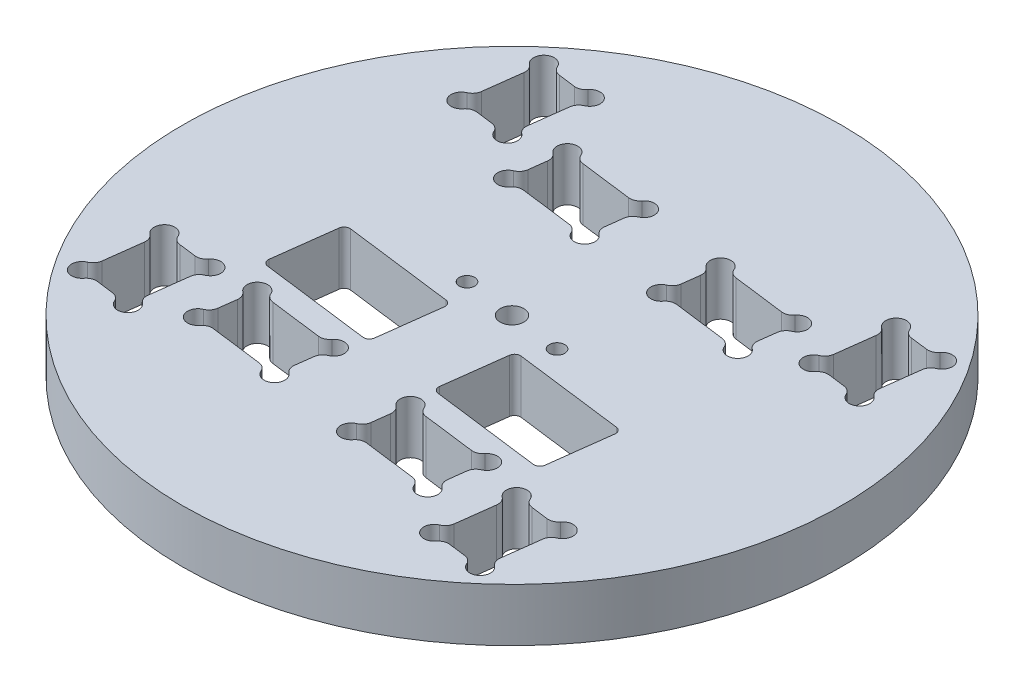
SolidWorks part; units mm, degrees
ref_plane "Front Plane" through (0, 0, 0) normal (0, 0, 1) x (1, 0, 0)
ref_plane "Top Plane" through (0, 0, 0) normal (0, 1, 0) x (1, 0, 0)
ref_plane "Right Plane" through (0, 0, 0) normal (1, 0, 0) x (0, 0, -1)
sketch "Sketch1" plane through (0, 0, 0) normal (0, 1, 0) x (1, 0, 0)
  line L1 (-78, -80) -> (78, -80) construction
  line L2 (-78, -80) -> (-78, 80) construction
  line L3 (-78, 80) -> (78, 80) construction
  line L4 (78, -80) -> (78, 80) construction
  line L5 (-78, -80) -> (78, 80) construction
  line L6 (-78, 80) -> (78, -80) construction
  arc A0 (-78, -80) -> (78, -80) centre (0, 0) ccw construction
  arc A1 (-78, -80) -> (78, -80) centre (0, 0) ccw construction
  arc A2 (78, 80) -> (-78, 80) centre (0, 0) ccw construction
  arc A3 (78, 80) -> (-78, 80) centre (0, 0) ccw construction
  circle A4 centre (0, 0) radius 111.7318
  dimension "D2" = 160
  dimension "D3" = 156
extrude "Boss-Extrude1" add sketch "Sketch1" along normal blind 18
sketch "Sketch3" plane through (0, 0, 0) normal (0, -1, 0) x (-1, 0, 0)
  line L0 (68.5117, 79.3104) -> (71.6763, 54.5115)
  line L1 (71.6763, 54.5115) -> (53.8211, 52.233)
  line L2 (53.8211, 52.233) -> (50.6565, 77.0319)
  line L3 (50.6565, 77.0319) -> (68.5117, 79.3104)
  line L4 (38.5517, 57.3413) -> (40.8302, 39.4861)
  line L5 (40.8302, 39.4861) -> (11.0715, 35.6885)
  line L6 (11.0715, 35.6885) -> (8.793, 53.5438)
  line L7 (8.793, 53.5438) -> (38.5517, 57.3413) construction
  line L8 (8.793, 53.5438) -> (11.0715, 35.6885) construction
  line L9 (8.793, 53.5438) -> (38.5517, 57.3413)
  line L10 (65.2136, -37.043) -> (68.3782, -61.8419)
  line L11 (68.3782, -61.8419) -> (86.2334, -59.5634)
  line L12 (86.2334, -59.5634) -> (83.0688, -34.7645)
  line L13 (83.0688, -34.7645) -> (65.2136, -37.043)
  line L14 (50.4505, -35.9026) -> (52.729, -53.7578)
  line L15 (52.729, -53.7578) -> (22.9703, -57.5553)
  line L16 (22.9703, -57.5553) -> (20.6918, -39.7001)
  line L17 (20.6918, -39.7001) -> (50.4505, -35.9026)
  line L18 (-20.9657, 49.7462) -> (-18.6872, 31.891)
  line L19 (-18.6872, 31.891) -> (-48.4459, 28.0935)
  line L20 (-48.4459, 28.0935) -> (-50.7244, 45.9487)
  line L21 (-50.7244, 45.9487) -> (-20.9657, 49.7462)
  line L22 (-9.0669, -43.4976) -> (-6.7884, -61.3528)
  line L23 (-6.7884, -61.3528) -> (-36.547, -65.1503)
  line L24 (-6.7884, -61.3528) -> (-36.547, -65.1503) construction
  line L25 (-36.547, -65.1503) -> (-38.8255, -47.2951)
  line L26 (-38.8255, -47.2951) -> (-9.0669, -43.4976) construction
  line L27 (-38.8255, -47.2951) -> (-36.547, -65.1503) construction
  line L28 (-38.8255, -47.2951) -> (-9.0669, -43.4976)
  line L29 (-53.8211, -52.233) -> (-50.6565, -77.0319)
  line L30 (-50.6565, -77.0319) -> (-68.5117, -79.3104)
  line L31 (-68.5117, -79.3104) -> (-71.6763, -54.5115)
  line L32 (-71.6763, -54.5115) -> (-53.8211, -52.233)
  line L33 (-68.3782, 61.8419) -> (-65.2136, 37.043)
  line L34 (-65.2136, 37.043) -> (-83.0688, 34.7645)
  line L35 (-83.0688, 34.7645) -> (-86.2334, 59.5634)
  line L36 (-83.0688, 34.7645) -> (-86.2334, 59.5634) construction
  line L37 (-86.2334, 59.5634) -> (-68.3782, 61.8419)
extrude "Cut-Extrude1" cut sketch "Sketch3" against normal through all
sketch "Sketch4" plane through (0, 18, 0) normal (0, 1, 0) x (1, 0, 0)
  circle A0 centre (-68.5117, 79.3104) radius 3.5
  circle A1 centre (-50.6565, 77.0319) radius 3.5
  circle A2 centre (-71.6763, 54.5115) radius 3.5
  circle A3 centre (-53.8211, 52.233) radius 3.5
  circle A4 centre (-38.5517, 57.3413) radius 3.5
  circle A5 centre (-8.793, 53.5438) radius 3.5
  circle A6 centre (-40.8302, 39.4861) radius 3.5
  circle A7 centre (-11.0715, 35.6885) radius 3.5
  circle A8 centre (20.9657, 49.7462) radius 3.5
  circle A9 centre (50.7244, 45.9487) radius 3.5
  circle A10 centre (18.6872, 31.891) radius 3.5
  circle A11 centre (48.4459, 28.0935) radius 3.5
  circle A12 centre (68.3782, 61.8419) radius 3.5
  circle A13 centre (86.2334, 59.5634) radius 3.5
  circle A14 centre (65.2136, 37.043) radius 3.5
  circle A15 centre (83.0688, 34.7645) radius 3.5
  circle A16 centre (-83.0688, -34.7645) radius 3.5
  circle A17 centre (-65.2136, -37.043) radius 3.5
  circle A18 centre (-50.4505, -35.9026) radius 3.5
  circle A19 centre (-20.6918, -39.7001) radius 3.5
  circle A20 centre (-86.2334, -59.5634) radius 3.5
  circle A21 centre (-68.3782, -61.8419) radius 3.5
  circle A22 centre (-52.729, -53.7578) radius 3.5
  circle A23 centre (-22.9703, -57.5553) radius 3.5
  circle A24 centre (9.0669, -43.4976) radius 3.5
  circle A25 centre (38.8255, -47.2951) radius 3.5
  circle A26 centre (6.7884, -61.3528) radius 3.5
  circle A27 centre (36.547, -65.1503) radius 3.5
  circle A28 centre (53.8211, -52.233) radius 3.5
  circle A29 centre (71.6763, -54.5115) radius 3.5
  circle A30 centre (50.6565, -77.0319) radius 3.5
  circle A31 centre (68.5117, -79.3104) radius 3.5
  dimension "D1" = 7
extrude "Cut-Extrude2" cut sketch "Sketch4" against normal through all both and the other way through all
fillet "Fillet1" radius 3.5 64 edges at (35.3537, 9, 46.8521) (38.3825, 9, 50.767) (12.5387, 9, 43.9407) (8.6238, 9, 46.9695) (7.2314, 9, 57.881) (10.2602, 9, 61.7959) (36.9901, 9, 61.6785) (33.0752, 9, 64.7073) (68.9548, 9, 75.8386) (71.2333, 9, 57.9834) (68.2045, 9, 54.0685) (57.2929, 9, 52.6761) (53.3781, 9, 55.7049) (51.0996, 9, 73.5601) (54.1284, 9, 77.475) (65.0399, 9, 78.8674) (79.597, 9, -35.2075) (83.5119, 9, -38.2364) (85.7904, 9, -56.0916) (82.7616, 9, -60.0064) (71.85, 9, -61.3989) (67.9352, 9, -58.3701) (65.6567, 9, -40.5149) (68.6855, 9, -36.6) (47.2525, 9, -46.3918) (50.2813, 9, -42.4769) (48.8889, 9, -31.5654) (44.974, 9, -28.5366) (24.4375, 9, -49.3032) (22.159, 9, -31.448) (20.5227, 9, -46.2744) (19.1302, 9, -35.3629) (-12.2648, 9, -53.9868) (-9.236, 9, -50.0719) (-10.6284, 9, -39.1604) (-14.5433, 9, -36.1316) (-35.0798, 9, -56.8982) (-37.3583, 9, -39.043) (-40.3871, 9, -42.9579) (-38.9947, 9, -53.8694) (-53.3781, 9, -55.7049) (-57.2929, 9, -52.6761) (-51.0996, 9, -73.5601) (-54.1284, 9, -77.475) (-65.0399, 9, -78.8674) (-68.9548, 9, -75.8386) (-68.2045, 9, -54.0685) (-71.2333, 9, -57.9834) (-21.1349, 9, 43.172) (-22.5273, 9, 54.0835) (-24.1637, 9, 39.2571) (-26.4422, 9, 57.1123) (-49.2572, 9, 54.2009) (-46.9787, 9, 36.3456) (-50.8935, 9, 39.3744) (-52.286, 9, 50.286) (-67.9352, 9, 58.3701) (-65.6567, 9, 40.5149) (-68.6855, 9, 36.6) (-79.597, 9, 35.2075) (-83.5119, 9, 38.2364) (-85.7904, 9, 56.0916) (-82.7616, 9, 60.0064) (-71.85, 9, 61.3989)
sketch "Sketch5" plane through (0, 18, 0) normal (0, 1, 0) x (1, 0, 0)
  line L0 (-17.5, 2.2332) -> (17.5, -2.2332) construction
  line L1 (15.0803, -44.265) -> (32.8121, -46.5277) construction
  circle A0 centre (0, 0) radius 4
  circle A1 centre (17.5, -2.2332) radius 2.6
  circle A2 centre (-17.5, 2.2332) radius 2.6
  point P5 (0, 0)
  dimension "D1" = 8
  dimension "D3" = 5.2
  dimension "D4" = 5.2
  dimension "D2" = 35
extrude "Cut-Extrude3" cut sketch "Sketch5" against normal through all both and the other way through all
sketch "Sketch7" plane through (0, 18, 0) normal (0, 1, 0) x (1, 0, 0)
  line L0 (0, 0) -> (-4.0183, -31.4893) construction
  line L1 (7.5557, -55.3394) -> (8.2995, -49.511) construction
  line L2 (11.5309, -10.1642) -> (8.3407, -35.1642)
  line L3 (8.3407, -35.1642) -> (49.3407, -40.3962)
  line L4 (49.3407, -40.3962) -> (52.5309, -15.3962)
  line L5 (52.5309, -15.3962) -> (11.5309, -10.1642)
  line L6 (-13.714, -6.9427) -> (-16.9042, -31.9427)
  line L7 (-16.9042, -31.9427) -> (-57.9042, -26.7107)
  line L8 (-57.9042, -26.7107) -> (-54.714, -1.7107)
  line L9 (-54.714, -1.7107) -> (-13.714, -6.9427)
  dimension "D1" = 25
  dimension "D2" = 41
extrude "Cut-Extrude4" cut sketch "Sketch7" against normal through all both and the other way through all
fillet "Fillet2" radius 2 8 edges at (-57.9042, 9, 26.7107) (-16.9042, 9, 31.9427) (-13.714, 9, 6.9427) (-54.714, 9, 1.7107) (8.3407, 9, 35.1642) (49.3407, 9, 40.3962) (11.5309, 9, 10.1642) (52.5309, 9, 15.3962)
